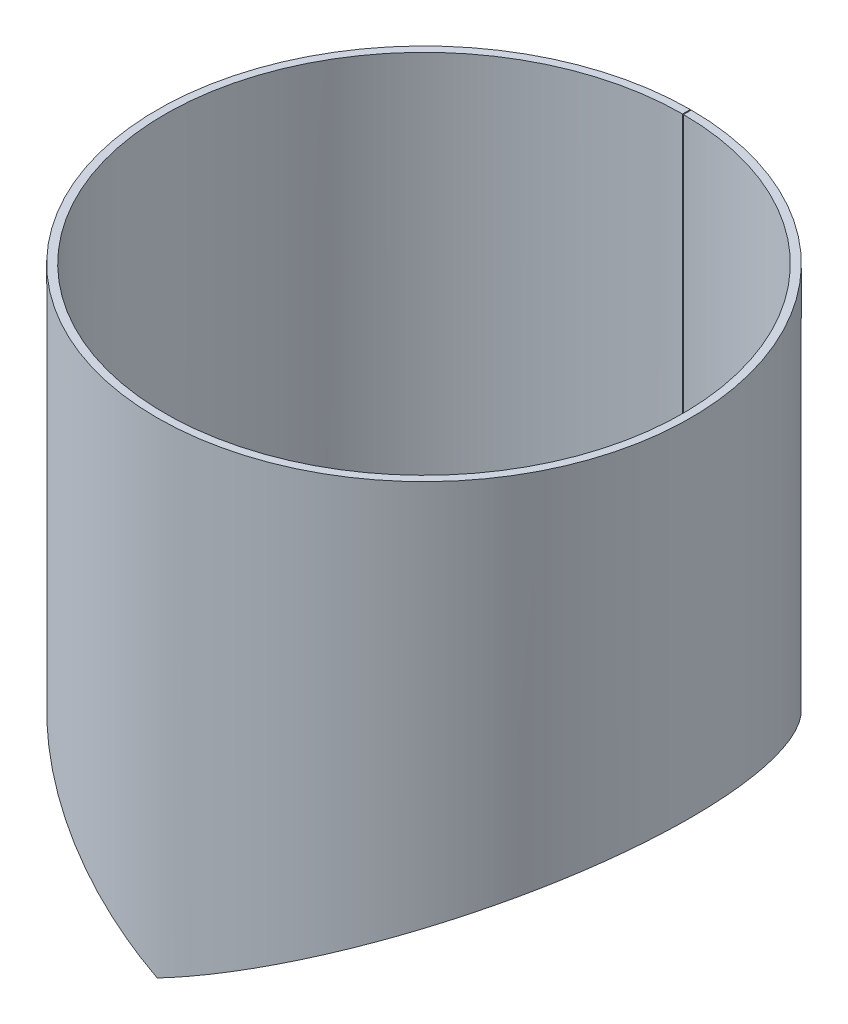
SolidWorks part; units mm, degrees
ref_plane "前视基准面" through (0, 0, 0) normal (0, 0, 1) x (1, 0, 0)
ref_plane "上视基准面" through (0, 0, 0) normal (0, 1, 0) x (1, 0, 0)
ref_plane "右视基准面" through (0, 0, 0) normal (1, 0, 0) x (0, 0, -1)
imported_body "基体零件-Y形补料管-1"
sheet metal parameters "钣金1" parameters "D1"=0.7366, "厚度"=8
bend "圆角折弯1" bend radius 267 bend angle 359.792 parameters "D5"=1
flatten bends "展开-折弯1" parameters "D1"=0
sketch "尖角-草图1" plane through (-0.5, 250.1301, -274.9995) normal (-0.0018, 0, -1) x (-1, 0, 0.0018)
  line L0 (838.3198, 249.8699) -> (838.3198, -249.8699) construction
process bends "加工-折弯1" parameters "D1"=0
sketch "平面-草图1" plane through (-0.5, 250.1301, -274.9995) normal (-0.0018, 0, -1) x (-1, 0, 0.0018)
